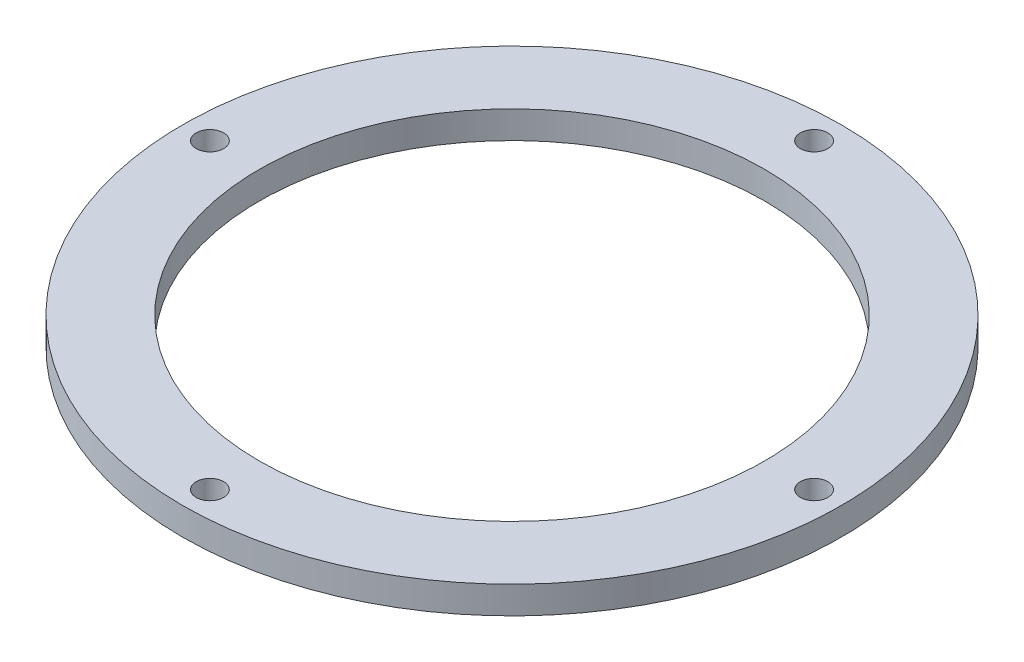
SolidWorks part; units mm, degrees
ref_plane "Front Plane" through (0, 0, 0) normal (0, 0, 1) x (1, 0, 0)
ref_plane "Top Plane" through (0, 0, 0) normal (0, 1, 0) x (1, 0, 0)
ref_plane "Right Plane" through (0, 0, 0) normal (1, 0, 0) x (0, 0, -1)
sketch "Sketch1" plane through (0, 0, 0) normal (0, 1, 0) x (1, 0, 0)
  circle A0 centre (0, 0) radius 60
  circle A1 centre (0, 0) radius 46
  dimension "D1" = 92
  dimension "D2" = 120
extrude "Boss-Extrude1" add sketch "Sketch1" along normal blind 5
sketch "Sketch2" plane through (0, 5, 0) normal (0, 1, 0) x (1, 0, 0)
  circle A0 centre (0, 55) radius 2.5
  circle A1 centre (55, 0) radius 2.5
  circle A2 centre (0, -55) radius 2.5
  circle A3 centre (-55, 0) radius 2.5
  point P0 (0, 55)
  point P5 (55, 0)
  point P6 (0, -55)
  point P7 (-55, 0)
  point P8 (0, 0)
  dimension "D1" = 55
extrude "Cut-Extrude1" cut sketch "Sketch2" against normal through all
